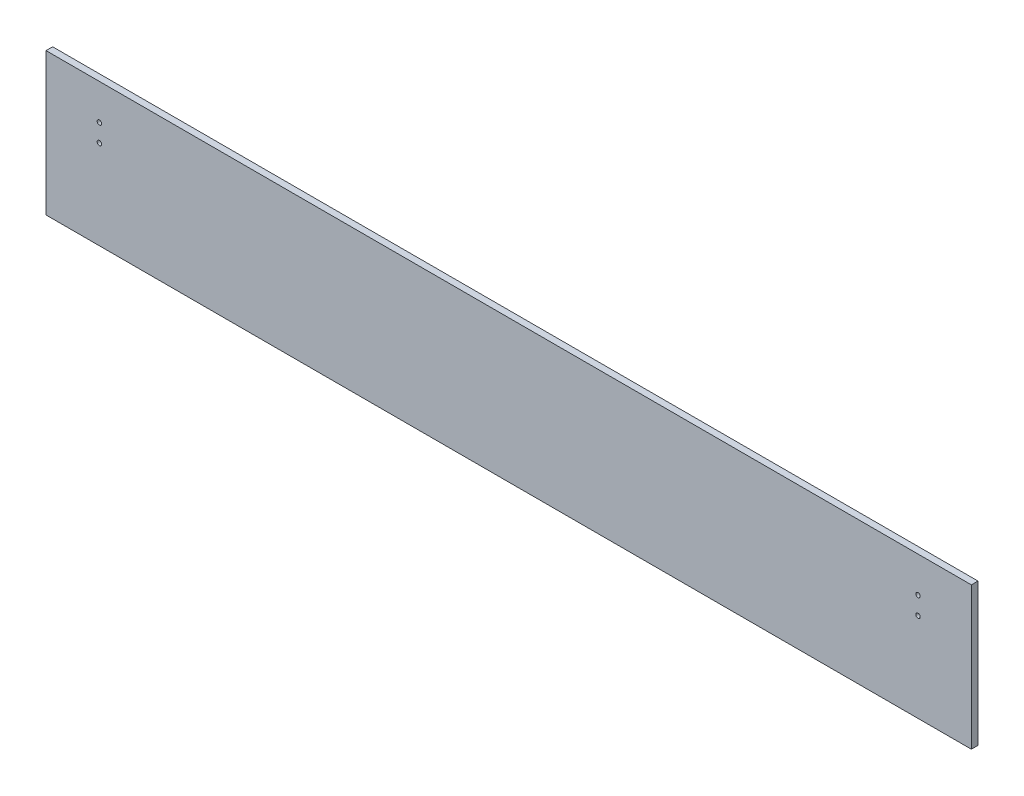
SolidWorks part; units mm, degrees
ref_plane "Front Plane" through (0, 0, 0) normal (0, 0, 1) x (1, 0, 0)
ref_plane "Top Plane" through (0, 0, 0) normal (0, 1, 0) x (1, 0, 0)
ref_plane "Right Plane" through (0, 0, 0) normal (1, 0, 0) x (0, 0, -1)
sketch "Sketch1" plane through (0, 0, 0) normal (0, 0, 1) x (1, 0, 0)
  line L1 (0, 0) -> (330.2, 0)
  line L2 (0, 0) -> (0, -50.8)
  line L3 (0, -50.8) -> (330.2, -50.8)
  line L4 (330.2, 0) -> (330.2, -50.8)
  dimension "D1" = 330.2
  dimension "D2" = 50.8
extrude "Boss-Extrude1" add sketch "Sketch1" along normal blind 2.3622
hole_wizard "1/16 (0.0625) Diameter Hole1" positions "Sketch2" profile "Sketch3" hole size "1/16" standard "ANSI Inch"
sketch "Sketch2" plane through (0, 0, 2.3622) normal (0, 0, 1) x (1, 0, 0)
  line L0 (0, -50.8) -> (330.2, -50.8) construction
  point P10 (19.05, -12.7)
  point P12 (19.05, -19.05)
  point P14 (311.15, -12.7)
  point P16 (311.15, -19.05)
  dimension "D1" = 12.7
  dimension "D2" = 31.75
  dimension "D3" = 19.05
  dimension "D4" = 19.05
sketch "Sketch3" plane through (19.05, -12.7, 2.3622) normal (1, 0, 0) x (0, -1, 0)
  line L0 (0, 0) -> (0, 2.3622)
  line L1 (0, 2.3622) -> (0.7937, 2.3622)
  line L2 (0.7937, 2.3622) -> (0.7937, 0)
  line L5 (0.7937, 0) -> (0, 0)
  line L11 (0, -6.35) -> (0, 107.95) construction
  dimension "Thru Hole Dia." = 1.5875
  dimension "Thru Hole Depth" = 2.3622
